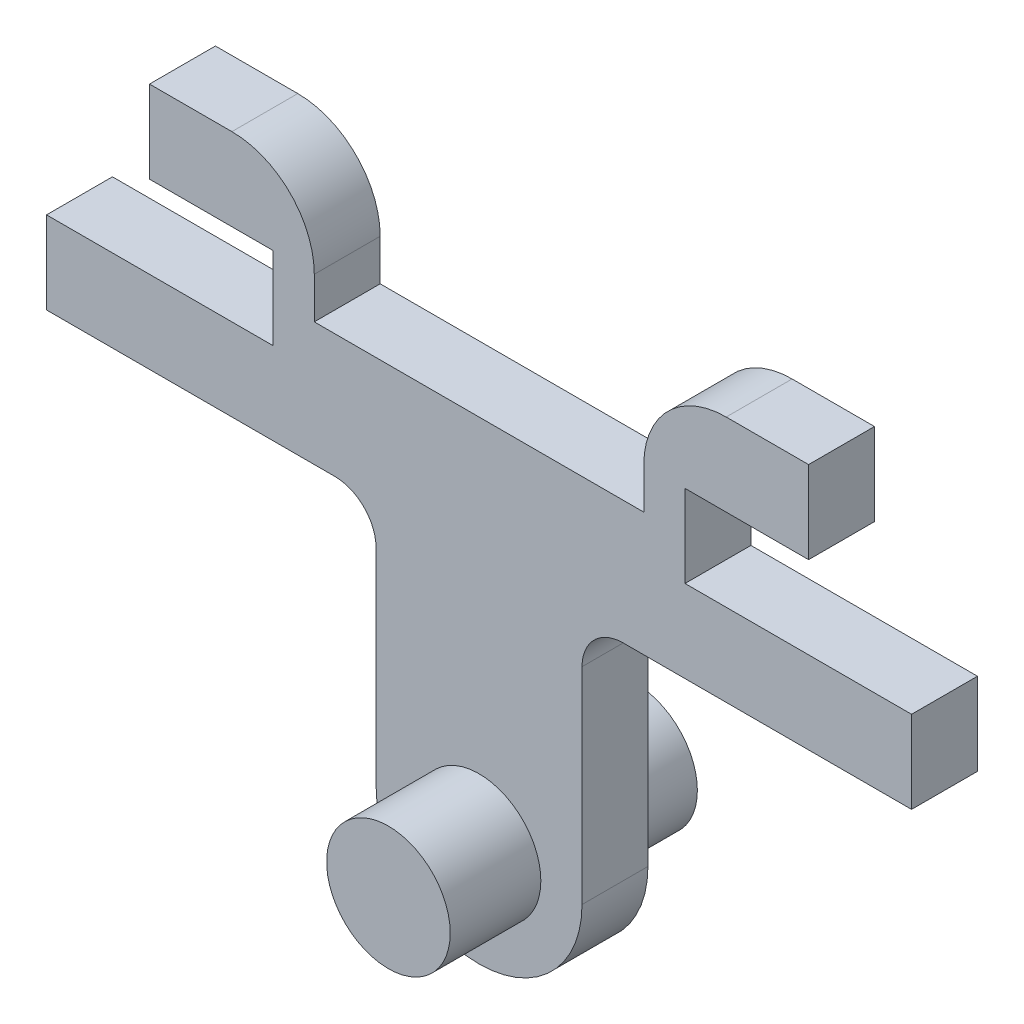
SolidWorks part; units mm, degrees
ref_plane "Front Plane" through (0, 0, 0) normal (0, 0, 1) x (1, 0, 0)
ref_plane "Top Plane" through (0, 0, 0) normal (0, 1, 0) x (1, 0, 0)
ref_plane "Right Plane" through (0, 0, 0) normal (1, 0, 0) x (0, 0, -1)
sketch "Sketch1" plane through (0, 0, 0) normal (0, 0, 1) x (1, 0, 0)
  circle A0 centre (0, 0) radius 7.5
  dimension "D1" = 15
extrude "Extrude1" add sketch "Sketch1" against normal mid plane 30
sketch "Sketch2" plane through (0, 0, 0) normal (0, 0, -1) x (-1, 0, 0)
  line L0 (-12.5, 0) -> (-12.5, 25)
  line L1 (-17.5, 30) -> (-52.5, 30)
  line L2 (-52.5, 30) -> (-52.5, 40)
  line L3 (-52.5, 40) -> (-25, 40)
  line L4 (-25, 40) -> (-25, 50)
  line L5 (-25, 50) -> (-40, 50)
  line L6 (-40, 50) -> (-40, 60)
  line L7 (-40, 60) -> (-30, 60)
  line L8 (-20, 50) -> (-20, 45)
  line L9 (0, 0) -> (0, 69.1208) construction
  line L10 (-20, 45) -> (20, 45)
  line L11 (20, 50) -> (20, 45)
  line L12 (40, 60) -> (30, 60)
  line L13 (40, 50) -> (40, 60)
  line L14 (25, 50) -> (40, 50)
  line L15 (25, 40) -> (25, 50)
  line L16 (52.5, 40) -> (25, 40)
  line L17 (52.5, 30) -> (52.5, 40)
  line L18 (17.5, 30) -> (52.5, 30)
  line L19 (12.5, 0) -> (12.5, 25)
  arc A0 (-12.5, 0) -> (12.5, 0) centre (0, 0) ccw
  arc A1 (20, 50) -> (30, 60) centre (30, 50) cw
  arc A2 (-30, 60) -> (-20, 50) centre (-30, 50) cw
  arc A3 (17.5, 30) -> (12.5, 25) centre (17.5, 25) ccw
  arc A4 (-12.5, 25) -> (-17.5, 30) centre (-17.5, 25) ccw
  point P16 (0, 45)
  point P26 (20, 60)
  point P29 (-20, 60)
  point P32 (12.5, 30)
  point P35 (-12.5, 30)
  dimension "D1" = 25
  dimension "D10" = 10
  dimension "D11" = 10
  dimension "D12" = 5
  dimension "D2" = 30
  dimension "D3" = 10
  dimension "D4" = 20
  dimension "D5" = 30
  dimension "D6" = 15
  dimension "D7" = 40
  dimension "D8" = 15
  dimension "D9" = 20
extrude "Extrude2" add sketch "Sketch2" against normal mid plane 8
